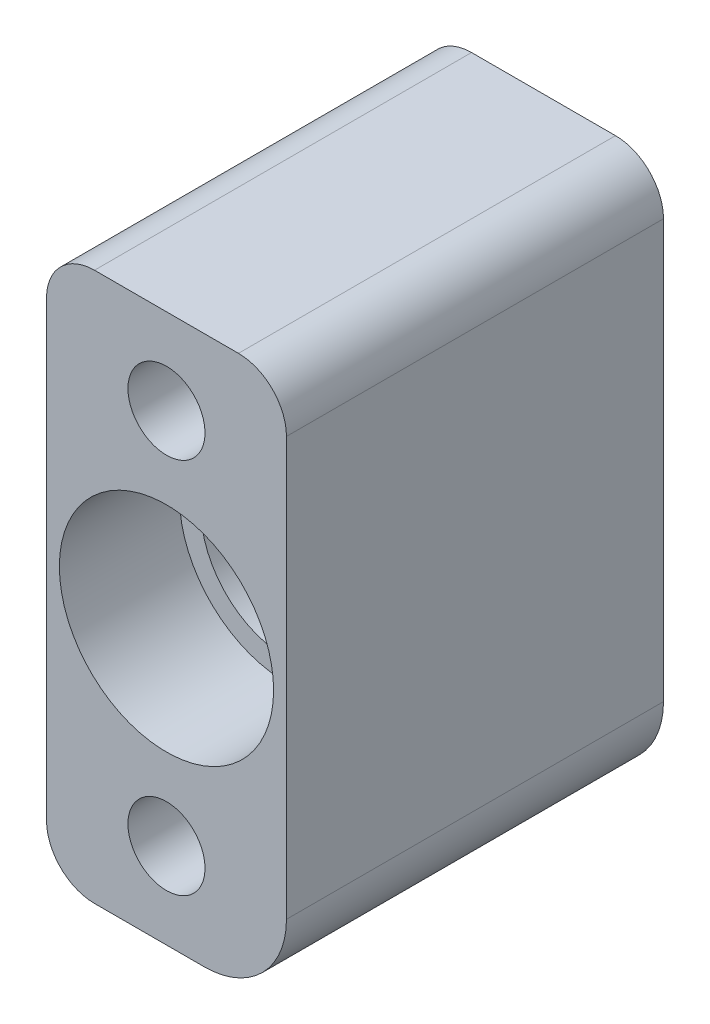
SolidWorks part; units mm, degrees
ref_plane "Front" through (0, 0, 0) normal (0, 0, 1) x (1, 0, 0)
ref_plane "Top" through (0, 0, 0) normal (0, 1, 0) x (1, 0, 0)
ref_plane "Right" through (0, 0, 0) normal (1, 0, 0) x (0, 0, -1)
ref_plane "Plane1"
sketch "Sketch1" plane through (0, 0, 40.2082) normal (0, 0, -1) x (-1, 0, 0)
  line L0 (749.9663, -30.9504) -> (772.1913, -30.9504) construction
  line L1 (754.4113, -5.5504) -> (767.7463, -5.5504)
  line L2 (749.9663, -9.9954) -> (749.9663, -48.7304)
  line L3 (757.5863, -56.3504) -> (767.7463, -56.3504)
  line L4 (772.1913, -9.9954) -> (772.1913, -51.9054)
  circle A1 centre (761.0788, -30.9504) radius 7.1746 construction
  circle A2 centre (761.0788, -30.9504) radius 7.1746 construction
  arc A3 (749.9663, -48.7304) -> (757.5863, -56.3504) centre (757.5863, -48.7304) ccw
  arc A4 (767.7463, -5.5504) -> (772.1913, -9.9954) centre (767.7463, -9.9954) cw
  arc A5 (767.7463, -56.3504) -> (772.1913, -51.9054) centre (767.7463, -51.9054) ccw
  arc A6 (754.4113, -5.5504) -> (749.9663, -9.9954) centre (754.4113, -9.9954) ccw
  point P4 (761.0788, -30.9504)
extrude "Boss-Extrude1" add sketch "Sketch1" against normal blind 31.75 flip side to cut
hole_wizard "Hole1" positions "Point_Sketch" profile "Profil_Sketch" counterbore size "1/4" standard "ANSI Inch"
sketch "Point_Sketch" plane through (-773.9479, -30.0154, 71.9582) normal (0, 0, -1) x (1, 0, 0)
  point P0 (12.8691, 0.935)
sketch "Profil_Sketch" plane through (-761.0788, -30.9504, 71.9582) normal (1, 0, 0) x (0, -1, 0)
  line L0 (0, 0) -> (0, 31.75)
  line L1 (0, 31.75) -> (7.9375, 31.75)
  line L3 (7.9375, 31.75) -> (7.9375, 11.1252)
  line L4 (7.9375, 11.1252) -> (9.9219, 11.1252)
  line L5 (9.9219, 11.1252) -> (9.9219, 0)
  line L7 (9.9219, 0) -> (0, 0)
  line L11 (0, -6.35) -> (0, 107.95) construction
  dimension "Diameter" = 15.875
  dimension "Thru Hole Depth" = 31.75
  dimension "L1" = 11.1252
other "usin_LS160_IMPAX VARIABLE INCH ISPV 062-300 4 RD P=0.5250<1>"
hole_wizard "Hole11" positions "Point_Sketch1" profile "Profil_Sketch1" counterbore size "1/4" standard "ANSI Inch"
sketch "Point_Sketch1" plane through (-748.2097, -15.7279, 40.2082) normal (0, 0, 1) x (-1, 0, 0)
  point P0 (12.8691, -2.24)
  point P2 (12.8691, 32.685)
sketch "Profil_Sketch1" plane through (-761.0788, -13.4879, 40.2082) normal (1, 0, 0) x (0, 1, 0)
  line L0 (0, 0) -> (0, 31.75)
  line L1 (0, 31.75) -> (3.5687, 31.75)
  line L3 (3.5687, 31.75) -> (3.5687, 9.652)
  line L4 (3.5687, 9.652) -> (5.3594, 9.652)
  line L5 (5.3594, 9.652) -> (5.3594, 0)
  line L7 (5.3594, 0) -> (0, 0)
  line L11 (0, -6.35) -> (0, 107.95) construction
  dimension "Diameter" = 7.1374
  dimension "Thru Hole Depth" = 31.75
  dimension "L1" = 9.652
other "usin_LS160_.25-20x1.75-SHCS<2>"
other "Move Face1" parameters "D1"=3.175
